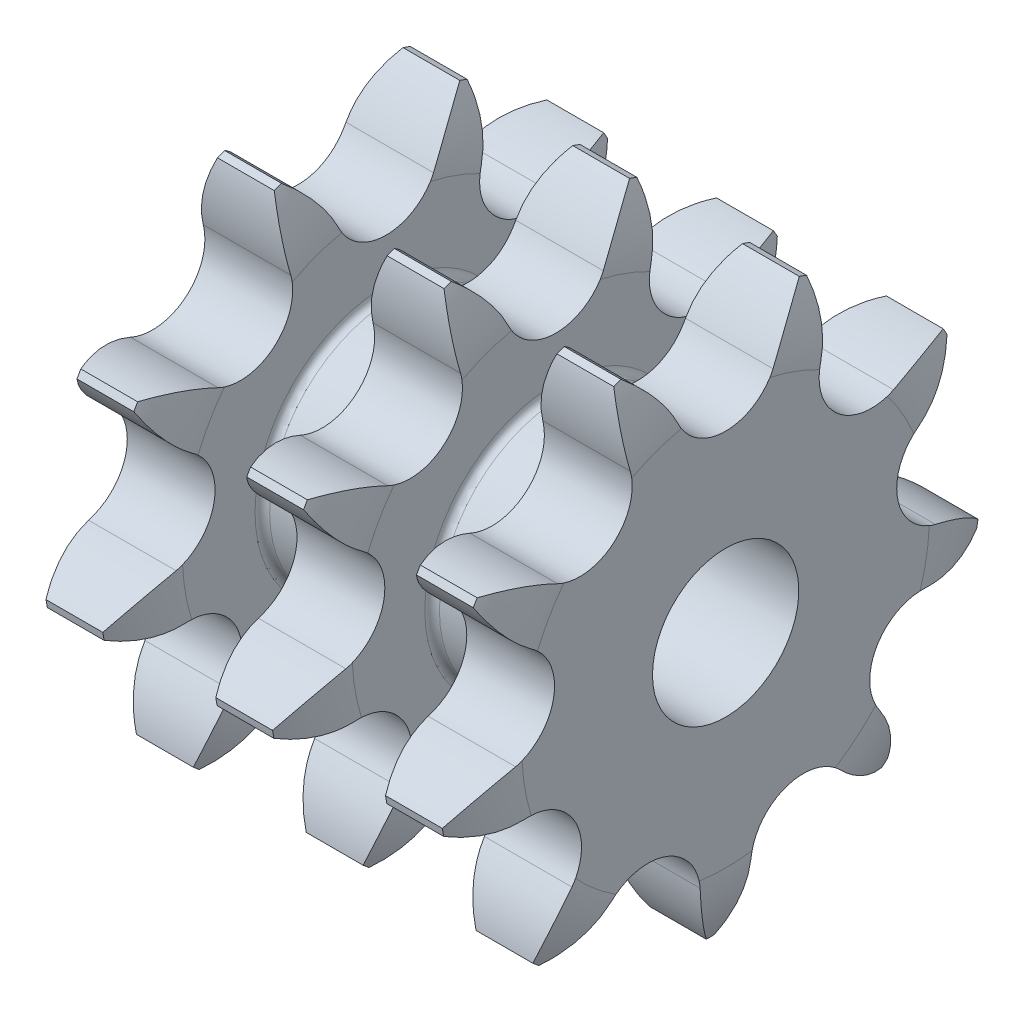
SolidWorks part; units mm, degrees
ref_plane "Plane1" through (0, 0, 0) normal (0, 0, 1) x (1, 0, 0)
ref_plane "Plane2" through (0, 0, 0) normal (0, 1, 0) x (1, 0, 0)
ref_plane "Plane3" through (0, 0, 0) normal (1, 0, 0) x (0, 0, -1)
sketch "Clipboard" plane through (0, 0, 0) normal (0, 1, 0) x (1, 0, 0)
  line L0 (0, 0) -> (12.5436, -1.9867)
  line L1 (-15, 0) -> (100, 0) construction
  line L2 (0, 0) -> (-0.8416, 0.9512)
  line L3 (0, 0) -> (-11.863, 4.5341)
  line L4 (0, 0) -> (3.0618, 0.4849)
  line L5 (0, 0) -> (-2.8109, -1.0484)
  line L6 (0, 0) -> (-29.0469, -19.598)
  line L7 (-0.8416, 0.9512) -> (35.5852, 8.6939)
  line L8 (-76.2, 38.1) -> (-75.2, 38.1)
  line L9 (-73.4259, 41.6592) -> (-72.8306, 41.7344)
  line L10 (-73.4741, 12.7512) -> (-59.5541, 12.7512)
  circle A0 centre (0, 0) radius 4.255
  circle A1 centre (0, 0) radius 10.1515
  circle A2 centre (0, 0) radius 25
  dimension "Dr" = 8.51
  dimension "MHD" = 20.303
  dimension "Hub_dia" = 50
  dimension "Num_teeth" = 9
  dimension "Pitch" = 12.7
  dimension "Width" = 3.1
  dimension "Side_relief" = 1.27
  dimension "Side_radius" = 12.7
  dimension "Overall_len" = 3
  dimension "Show_teeth" = 9
  dimension "Thickness" = 35.04
  dimension "OAL" = 37.2405
  dimension "T_dim" = 1
  dimension "Fillet_rad" = 0.6
  dimension "Face_width" = 7.2
  dimension "Num_strands" = 3
  dimension "Transv_pitch" = 13.92
  dimension "Plate_wid" = 11.8
sketch "BasProSke" plane through (0, 0, 0) normal (0, 1, 0) x (1, 0, 0)
  line L0 (-10, 0) -> (60, 0) construction
  line L1 (0, 0) -> (0, 16.7129)
  line L2 (0, 0) -> (35.04, 0)
  line L3 (35.04, 0) -> (35.04, 16.7129)
  line L4 (33.77, 22.2487) -> (1.27, 22.2487)
  arc A0 (0, 16.7129) -> (1.27, 22.2487) centre (12.7, 16.7129) cw
  arc A1 (35.04, 16.7129) -> (33.77, 22.2487) centre (22.34, 16.7129) ccw
  dimension "D1" = 12.7
  dimension "G1" = 1.27
  dimension "G2" = 1.27
  dimension "Diameter" = 44.4973
  dimension "Thickness" = 35.04
revolve "Base-Revolve" add sketch "BasProSke" angle 360 about L0
sketch "GrvSke" plane through (0, 0, 0) normal (0, 1, 0) x (1, 0, 0)
  line L0 (7.2, 16.7129) -> (7.2, 10.7515)
  line L1 (7.8, 10.1515) -> (13.32, 10.1515)
  line L2 (13.92, 10.7515) -> (13.92, 16.7129)
  line L3 (5.93, 22.2487) -> (15.19, 22.2487)
  line L4 (10.56, 0) -> (10.56, 52.07) construction
  line L5 (-10, 0) -> (60, 0) construction
  line L6 (0, 0) -> (35.56, 0) construction
  arc A0 (13.92, 16.7129) -> (15.19, 22.2487) centre (26.62, 16.7129) cw
  arc A1 (7.2, 16.7129) -> (5.93, 22.2487) centre (-5.5, 16.7129) ccw
  arc A2 (7.2, 10.7515) -> (7.8, 10.1515) centre (7.8, 10.7515) ccw
  arc A3 (13.32, 10.1515) -> (13.92, 10.7515) centre (13.32, 10.7515) ccw
  dimension "D1" = 12.7
  dimension "Fillet_rad" = 0.6
  dimension "Diameter" = 44.4973
  dimension "Grv_diam" = 20.303
  dimension "Grv_width" = 6.72
  dimension "Offset" = 10.56
  dimension "G1" = 1.27
revolve "Groove" cut sketch "GrvSke" angle 360 about L6
pattern_linear "Grooves" count 2 spacing 13.92 along (1, 0, 0) of "Groove"
sketch "TooCutSke" plane through (0, 0, 0) normal (1, 0, 0) x (0, 0, -1)
  line L0 (0, 18.6087) -> (3.8949, 16.7925) construction
  line L1 (0, 0) -> (0, 107) construction
  line L2 (0, 18.6087) -> (-10, 18.6087) construction
  line L3 (0, 18.6087) -> (-3.8949, 16.7925) construction
  arc A0 (3.8949, 16.7925) -> (7.8075, 21.3669) centre (14.0756, 12.0451) cw
  arc A1 (3.8949, 16.7925) -> (-3.8949, 16.7925) centre (0, 18.6087) cw
  arc A2 (-3.8949, 16.7925) -> (-7.8075, 21.3669) centre (-14.0756, 12.0451) ccw
  arc A3 (7.8075, 21.3669) -> (-7.8075, 21.3669) centre (0, 0) ccw
  dimension "R1" = 4.2976
  dimension "R2" = 11.2332
  dimension "Overcut" = 22.7487
  dimension "Seat_radius" = 18.6087
  dimension "X" = 130
extrude "ToothCut" cut sketch "TooCutSke" along normal through all
pattern_circular "TeethCuts" count 9 every 40 about axis through (-10, 0, 0) along (1, 0, 0) of "ToothCut"
sketch "HubNeaOneSke" plane through (0, 0, 0) normal (-1, 0, 0) x (0, 0, 1)
  circle A0 centre (0, 0) radius 10.1515
  dimension "Diameter" = 20.303
extrude "HubNearOne" [suppressed] add sketch "HubNeaOneSke" along normal blind 2.2005
fillet "HubNearOneFillet" [suppressed] radius 0.6
sketch "HubNeaBotSke" plane through (0, 0, 0) normal (-1, 0, 0) x (0, 0, 1)
  circle A0 centre (0, 0) radius 10.1515
  dimension "Diameter" = 20.303
extrude "HubNearBoth" [suppressed] add sketch "HubNeaBotSke" along normal blind 1.1003
fillet "HubNearBothFillet" [suppressed] radius 0.6
ref_plane "FarPln" through (35.04, 0, 0) normal (1, 0, 0) x (0, 0, -1)
sketch "HubFarSke" plane through (35.04, 0, 0) normal (1, 0, 0) x (0, 0, -1)
  circle A0 centre (0, 0) radius 10.1515
  dimension "Diameter" = 20.303
extrude "HubFar" [suppressed] add sketch "HubFarSke" along normal blind 1.1003
fillet "HubFarFillet" [suppressed] radius 0.6
sketch "BorSke" plane through (0, 0, 0) normal (1, 0, 0) x (0, 0, -1)
  circle A0 centre (0, 0) radius 6
  dimension "Diameter" = 12
extrude "Bore" cut sketch "BorSke" along normal mid plane 74.481
sketch "KeySke" plane through (0, 0, 0) normal (1, 0, 0) x (0, 0, -1)
  line L0 (-1, 0) -> (-1, 7)
  line L1 (-1, 7) -> (1, 7)
  line L2 (1, 7) -> (1, 0)
  line L3 (0, 0) -> (0, 34) construction
  line L4 (-1, 0) -> (1, 0)
  dimension "Offset" = 7
  dimension "Width" = 2
extrude "Keyway" [suppressed] cut sketch "KeySke" along normal mid plane 74.481
pattern_circular "Keyway2" [suppressed] count 2 every 90 about axis through (-10, 0, 0) along (1, 0, 0)
equation "' \"Pitch@Clipboard\" = 12.7"
equation "' \"Num_strands@Clipboard\" = 3"
equation "' \"Num_teeth@Clipboard\" = 9"
equation "' \"Hub_dia@Clipboard\" = 50"
equation "' \"Overall_len@Clipboard\" = 3"
equation "' \"Diameter@BorSke\" = 12"
equation "' \"T_dim@Clipboard\" = 1"
equation "' \"Width@KeySke\" = 2"
equation "' \"Dr@Clipboard\" = 8.51"
equation "' \"Face_width@Clipboard\" = 7.2"
equation "' \"Side_radius@Clipboard\" = 12.7"
equation "' \"Side_relief@Clipboard\" = 1.27"
equation "' \"Transv_pitch@Clipboard\" = 13.92"
equation "' \"Show_teeth@Clipboard\" = 9"
equation "' \"Fillet_rad@Clipboard\" = 0.6"
equation "' \"Plate_wid@Clipboard\" = 11.8"
equation "\"Num_teeth@Clipboard\" = int( \"Num_teeth@Clipboard\" )"
equation "\"Num_teeth@Clipboard\" = ((sgn( \"Num_teeth@Clipboard\" - 5.0)+1)*( \"Num_teeth@Clipboard\" - 5.0))/2 +5.0"
equation "\"Num_teeth@Clipboard\" = ((sgn( \"Num_teeth@Clipboard\" - 200.0)-1)*( \"Num_teeth@Clipboard\" - 200.0))/-2 +200.0"
equation "\"MHD@Clipboard\" = \"Pitch@Clipboard\" * (1.0 / tan(3.14159265 / \"Num_teeth@Clipboard\" )) - 1.05 * \"Plate_wid@Clipboard\" - 2.0 * \"Fillet_rad@Clipboard\" - 1.0"
equation "\"Thickness@Clipboard\"  = \"Face_width@Clipboard\" + (\"Num_strands@Clipboard\" - 1) * \"Transv_pitch@Clipboard\""
equation "\"OAL@Clipboard\" = \"Thickness@Clipboard\" + 2 * \"Fillet_rad@Clipboard\" + 1"
equation "\"MHD@Clipboard\" = ((sgn( \"MHD@Clipboard\" - \"Hub_dia@Clipboard\" )-1)*( \"MHD@Clipboard\" - \"Hub_dia@Clipboard\" ))/-2+ \"Hub_dia@Clipboard\""
equation "\"OAL@Clipboard\" = ((sgn( \"OAL@Clipboard\" - \"Overall_len@Clipboard\" )+1)*( \"OAL@Clipboard\" - \"Overall_len@Clipboard\" ))/2 + \"Overall_len@Clipboard\" + 0.0005"
equation "\"Num_teeth@TeethCuts\" = int( \"Show_teeth@Clipboard\" ) + 1"
equation "\"Num_teeth@TeethCuts\" = ((sgn( \"Num_teeth@TeethCuts\" - \"Num_teeth@Clipboard\" )-1)*( \"Num_teeth@TeethCuts\" - \"Num_teeth@Clipboard\" ))/-2+ \"Num_teeth@Clipboard\""
equation "\"Num_teeth@TeethCuts\" = ((sgn( \"Num_teeth@TeethCuts\" - 2.0)+1)*( \"Num_teeth@TeethCuts\" - 2.0))/2 +2.0"
equation "\"Angle@TeethCuts\" = 360.0 / \"Num_teeth@Clipboard\""
equation "\"Seat_radius@TooCutSke\" = ( \"Pitch@Clipboard\" / 2.0) / sin(3.14159265 / \"Num_teeth@Clipboard\" ) - \"Dr@Clipboard\" / 2.0 + \"Dr@Clipboard\" * 0.505"
equation "\"R1@TooCutSke\"  = \"Dr@Clipboard\" * 0.505"
equation "\"X@TooCutSke\" = 140.0 - (90.0 / \"Num_teeth@Clipboard\")"
equation "\"R2@TooCutSke\" = 0.12 * \"Dr@Clipboard\" * ( \"Num_teeth@Clipboard\" + 2.0)"
equation "\"Overcut@TooCutSke\" = 0.5 + 0.625 * \"Pitch@Clipboard\" - 0.5 * \"Dr@Clipboard\"  +  \"Pitch@Clipboard\" / 2.0 / sin(3.14159265 / \"Num_teeth@Clipboard\" )"
equation "\"Diameter@BasProSke\" = 2.0 * ( 0.625 * \"Pitch@Clipboard\" - 0.5 * \"Dr@Clipboard\"  +  \"Pitch@Clipboard\" / 2.0 / sin(3.14159265 / \"Num_teeth@Clipboard\" ))"
equation "\"Thickness@BasProSke\"  = \"Thickness@Clipboard\""
equation "\"G1@BasProSke\" =  \"Side_relief@Clipboard\""
equation "\"G2@BasProSke\" =  \"Side_relief@Clipboard\""
equation "\"D1@BasProSke\" =  \"Side_radius@Clipboard\""
equation "\"Diameter@GrvSke\" = \"Diameter@BasProSke\""
equation "\"G1@GrvSke\" = \"Side_relief@Clipboard\""
equation "\"D1@GrvSke\" = \"Side_radius@Clipboard\""
equation "\"Grv_diam@GrvSke\" =  \"Pitch@Clipboard\" * (1.0 / tan(3.14159265 / \"Num_teeth@Clipboard\" ))- 1.05 * \"Plate_wid@Clipboard\" - 2.0 * \"Fillet_rad@Clipboard\" - 1.0"
equation "\"Grv_width@GrvSke\" =  \"Transv_pitch@Clipboard\" - \"Face_width@Clipboard\""
equation "\"Offset@GrvSke\" = \"Grv_width@GrvSke\" / 2.0 + \"Face_width@Clipboard\""
equation "\"Fillet_rad@GrvSke\" = \"Fillet_rad@Clipboard\""
equation "\"Offset@Grooves\" = \"Transv_pitch@Clipboard\""
equation "\"Num_grvs@Grooves\" = \"Num_strands@Clipboard\""
equation "\"Num_grvs@Grooves\" = \"Num_grvs@Grooves\" - 1 * sgn( \"Num_grvs@Grooves\" -1)"
equation "\"Diameter@HubNeaOneSke\" = \"MHD@Clipboard\""
equation "\"Length@HubNearOne\" = \"OAL@Clipboard\" - \"Thickness@BasProSke\""
equation "\"Diameter@HubNeaBotSke\" = \"MHD@Clipboard\""
equation "\"Length@HubNearBoth\" = ( \"OAL@Clipboard\" - \"Thickness@BasProSke\" ) / 2.0"
equation "\"D1@HubNearOneFillet\" = \"Fillet_rad@Clipboard\""
equation "\"D1@HubNearBothFillet\" = \"Fillet_rad@Clipboard\""
equation "\"Thickness@FarPln\" = \"Thickness@BasProSke\""
equation "\"Diameter@HubFarSke\" = \"MHD@Clipboard\""
equation "\"Length@HubFar\" = ( \"OAL@Clipboard\" - \"Thickness@BasProSke\" ) / 2.0"
equation "\"D1@HubFarFillet\" = \"Fillet_rad@Clipboard\""
equation "\"D1@Bore\" = \"OAL@Clipboard\" * 2.0"
equation "\"D1@Keyway\" = \"OAL@Clipboard\" * 2.0"
equation "\"Offset@KeySke\" = \"T_dim@Clipboard\" + \"Diameter@BorSke\" / 2.0"
